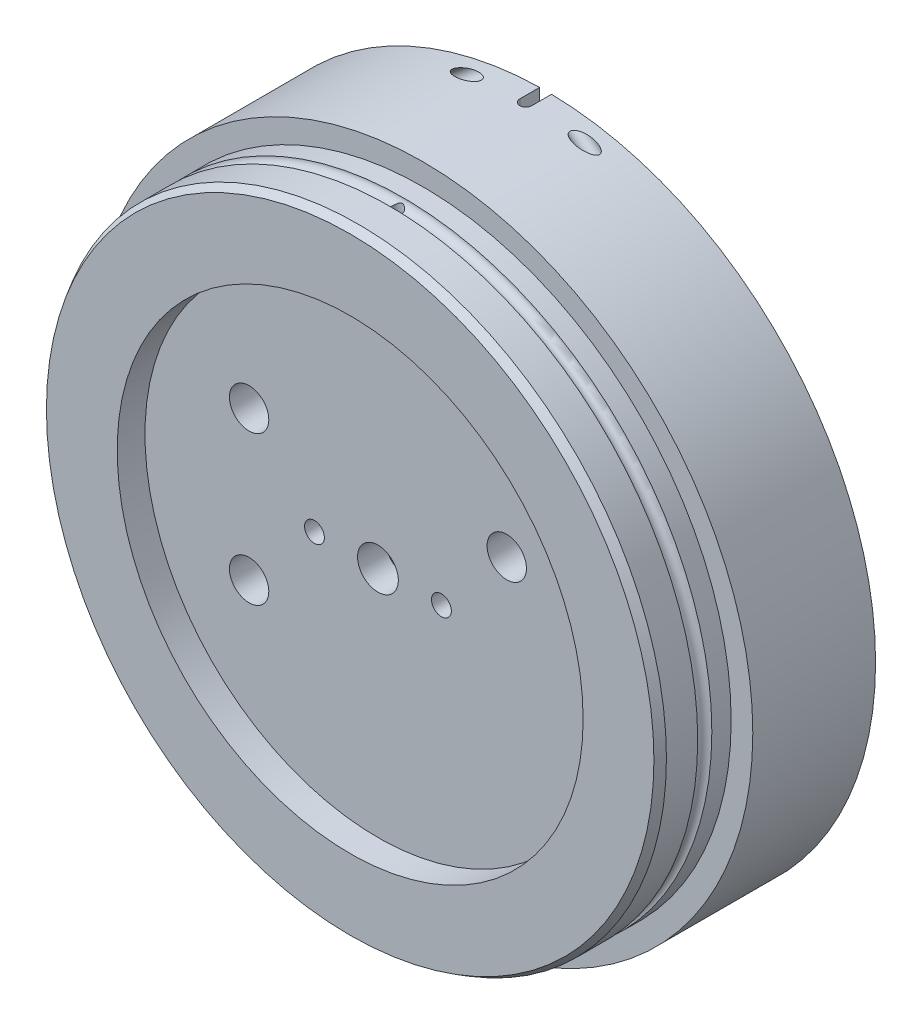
SolidWorks part; units mm, degrees
ref_plane "Front Plane" through (0, 0, 0) normal (0, 0, 1) x (1, 0, 0)
ref_plane "Top Plane" through (0, 0, 0) normal (0, 1, 0) x (1, 0, 0)
ref_plane "Right Plane" through (0, 0, 0) normal (1, 0, 0) x (0, 0, -1)
imported_body "Imported3"
sketch "Sketch1" plane through (0, 0, 38.43) normal (0, 0, 1) x (1, 0, 0)
  circle A0 centre (0, 0) radius 77.7286
extrude "Boss-Extrude1" add sketch "Sketch1" along normal blind 7.8868
sketch "Sketch2" plane through (0, 0, 46.3168) normal (0, 0, 1) x (1, 0, 0)
  circle A0 centre (0, 0) radius 77.7286
extrude "Boss-Extrude2" add sketch "Sketch2" along normal blind 2 draft 30
sketch "Sketch3" plane through (0, 0, 0) normal (0, 1, 0) x (1, 0, 0)
  line L0 (73.3542, 0.9514) -> (0, 0.9514)
  line L1 (0, 0.9514) -> (0, -48.3168)
  line L2 (0, -48.3168) -> (58.7306, -48.3168)
  line L3 (58.7306, -48.3168) -> (58.7306, -41.3168)
  line L4 (58.7306, -41.3168) -> (5.1434, -41.3168)
  line L5 (5.1434, -41.3168) -> (4.9362, -34.3968)
  line L6 (4.9362, -34.3968) -> (4.2164, -34.3968)
  line L7 (4.2164, -34.3968) -> (4.2164, -29.6968)
  line L8 (4.2164, -29.6968) -> (1.9197, -28.3168)
  line L9 (1.9197, -28.3168) -> (1.9197, -28.1168)
  line L10 (1.9197, -28.1168) -> (71.4375, -28.1168)
  line L11 (71.4375, -28.1168) -> (71.4375, -11.0906)
  line L12 (71.4375, -11.0906) -> (72.1995, -10.3286)
  line L13 (72.1995, -10.3286) -> (72.1995, -5.8286)
  line L14 (72.1995, -2.2686) -> (72.1995, -1.0486)
  line L15 (72.1995, -1.0486) -> (73.3542, 0.9514)
  line L16 (0, 0.9514) -> (0, -48.3168) construction
  arc A0 (72.1995, -5.8286) -> (72.1995, -2.2686) centre (72.1995, -4.0486) ccw
revolve "Cut-Revolve1" cut sketch "Sketch3" angle 360 about L16
ref_plane "Plane1" through (0, 76.6962, 0) normal (0, 1, 0) x (1, 0, 0)
hole_wizard "Ø2.9 (2.9) Diameter Hole1" positions "Sketch5" profile "Sketch4" hole size "Ø2.9" standard "ANSI Metric"
sketch "Sketch5" plane through (0, 76.6962, 0) normal (0, 1, 0) x (1, 0, 0)
  point P0 (0, -36.65)
sketch "Sketch4" plane through (0, 76.6962, 36.65) normal (1, 0, 0) x (0, 0, 1)
  line L0 (0, 0) -> (0, 5.1388)
  line L1 (0, 5.1388) -> (1.45, 4.2676)
  line L2 (1.45, 4.2676) -> (1.45, 0)
  line L5 (1.45, 0) -> (0, 0)
  line L10 (0, 5.1388) -> (-1.45, 4.2676) construction
  line L11 (0, -6.35) -> (0, 107.95) construction
  dimension "Hole Dia." = 2.9
  dimension "Hole Depth" = 4.2676
  dimension "Drill Angle" = 118
hole_wizard "Ø5.0 (5) Diameter Hole1" positions "Sketch7" profile "Sketch6" hole size "Ø5.0" standard "ANSI Metric"
sketch "Sketch7" plane through (0, 0, 41.3168) normal (0, 0, 1) x (1, 0, 0)
  point P0 (16, 0)
  point P1 (-16, 0)
sketch "Sketch6" plane through (16, 0, 41.3168) normal (1, 0, 0) x (0, -1, 0)
  line L0 (0, 0) -> (0, 10)
  line L1 (0, 10) -> (2.5, 10)
  line L2 (2.5, 10) -> (2.5, 0)
  line L5 (2.5, 0) -> (0, 0)
  line L10 (0, 10) -> (-2.5, 10) construction
  line L11 (0, -6.35) -> (0, 107.95) construction
  dimension "Hole Dia." = 5
  dimension "Hole Depth" = 10
  dimension "Drill Angle" = 180
hole_wizard "M8 Clearance Hole1" positions "Sketch9" profile "Sketch8" hole size "M8" standard "ANSI Metric"
sketch "Sketch9" plane through (0, 0, 41.3168) normal (0, 0, 1) x (1, 0, 0)
  point P0 (-32.476, 18.75)
  point P1 (32.476, 18.75)
  point P2 (-32.476, -18.75)
sketch "Sketch8" plane through (-32.476, 18.75, 41.3168) normal (1, 0, 0) x (0, -1, 0)
  line L0 (0, 0) -> (0, 42.2682)
  line L1 (0, 42.2682) -> (4.9606, 42.2682)
  line L2 (4.9606, 42.2682) -> (4.9606, 0)
  line L5 (4.9606, 0) -> (0, 0)
  line L11 (0, -6.35) -> (0, 107.95) construction
  dimension "Thru Hole Dia." = 9.9212
  dimension "Thru Hole Depth" = 42.2682
hole_wizard "Ø3.3 (3.3) Diameter Hole1" positions "Sketch11" profile "Sketch10" hole size "Ø3.3" standard "ANSI Metric"
sketch "Sketch11" plane through (0, 0, 28.1168) normal (0, 0, -1) x (-1, 0, 0)
  point P0 (-19.5, -48.5)
  point P1 (19.5, -48.5)
sketch "Sketch10" plane through (19.5, -48.5, 28.1168) normal (1, 0, 0) x (0, 1, 0)
  line L0 (0, 0) -> (0, 8.7)
  line L1 (0, 8.7) -> (1.65, 8.7)
  line L2 (1.65, 8.7) -> (1.65, 0)
  line L5 (1.65, 0) -> (0, 0)
  line L10 (0, 8.7) -> (-1.65, 8.7) construction
  line L11 (0, -6.35) -> (0, 107.95) construction
  dimension "Hole Dia." = 3.3
  dimension "Hole Depth" = 8.7
  dimension "Drill Angle" = 180
hole_wizard "Ø3.3 (3.3) Diameter Hole2" positions "Sketch13" profile "Sketch12" hole size "Ø3.3" standard "ANSI Metric"
sketch "Sketch13" plane through (0, 0, 28.1168) normal (0, 0, -1) x (-1, 0, 0)
  point P0 (-49.5, 0)
  point P1 (49.5, 0)
sketch "Sketch12" plane through (49.5, 0, 28.1168) normal (1, 0, 0) x (0, 1, 0)
  line L0 (0, 0) -> (0, 9.6914)
  line L1 (0, 9.6914) -> (1.65, 8.7)
  line L2 (1.65, 8.7) -> (1.65, 0)
  line L5 (1.65, 0) -> (0, 0)
  line L10 (0, 9.6914) -> (-1.65, 8.7) construction
  line L11 (0, -6.35) -> (0, 107.95) construction
  dimension "Hole Dia." = 3.3
  dimension "Hole Depth" = 8.7
  dimension "Drill Angle" = 118
